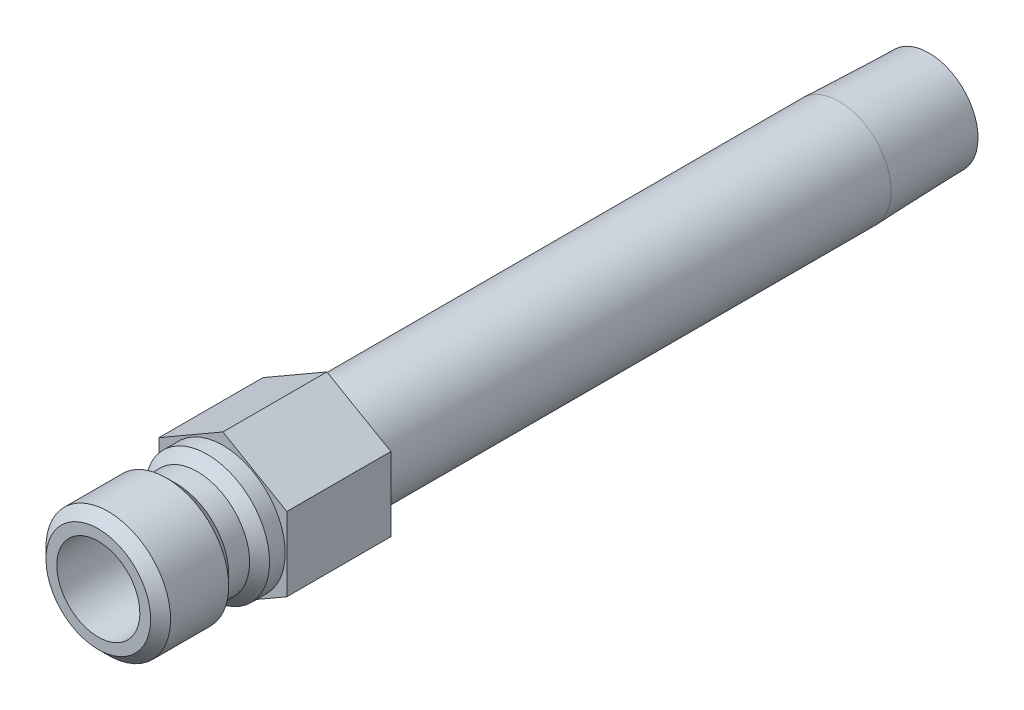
SolidWorks part; units mm, degrees
ref_plane "Front Plane" through (0, 0, 0) normal (0, 0, 1) x (1, 0, 0)
ref_plane "Top Plane" through (0, 0, 0) normal (0, 1, 0) x (1, 0, 0)
ref_plane "Right Plane" through (0, 0, 0) normal (1, 0, 0) x (0, 0, -1)
sketch "Sketch1" plane through (0, 0, 0) normal (1, 0, 0) x (0, 0, -1)
  line L0 (0, 0) -> (-12.7, 0) construction
  line L1 (-9.525, 3.175) -> (-9.525, 4.0005)
  line L2 (-3.556, 4.0005) -> (-3.556, 0) construction
  line L3 (-8.763, 4.7625) -> (-4.318, 4.7625)
  line L4 (0, 3.9688) -> (0, 3.175) construction
  line L5 (-3.556, 4.0005) -> (-1.9558, 4.0005)
  line L6 (-1.1938, 4.7625) -> (0, 4.7625)
  line L7 (0, 4.7625) -> (0, 3.9688)
  line L8 (-3.556, 4.0005) -> (-4.318, 4.7625)
  line L9 (-1.9558, 4.0005) -> (-1.1938, 4.7625)
  line L10 (-9.525, 4.0005) -> (-8.763, 4.7625)
  line L11 (0.127, 3.175) -> (0.127, 2.3813)
  line L12 (0, 3.9688) -> (47.117, 3.9688)
  line L13 (47.117, 3.9688) -> (53.975, 3.7544)
  line L14 (53.975, 3.7544) -> (53.975, 2.3813)
  line L15 (0, 0) -> (7.9502, 0) construction
  line L16 (7.9502, 0) -> (7.9502, 4.7625) construction
  line L17 (7.9502, 4.7625) -> (0, 4.7625) construction
  line L19 (0.127, 3.175) -> (-9.525, 3.175)
  line L20 (0.127, 2.3813) -> (53.975, 2.3813)
  line L21 (0, 2.6543) -> (0, 0) construction
  dimension "D1" = 9.525
  dimension "D2" = 1.6002
  dimension "D3" = 0.762
  dimension "D4" = 45
  dimension "D5" = 5.969
  dimension "D6" = 45
  dimension "D7" = 1.79
  dimension "D8" = 6.858
  dimension "D9" = 63.5
  dimension "D10" = 3.175
  dimension "D11" = 17.4752
  dimension "D12" = 6.35
  dimension "D13" = 4.7625
  dimension "D14" = 9.525
  dimension "D15" = 7.9375
  dimension "D16" = 9.652
revolve "Revolve1" add sketch "Sketch1" angle 360 about L0
sketch "Sketch2" plane through (0, 0, 0) normal (0, 0, 1) x (1, 0, 0)
  line L1 (-4.8895, 2.823) -> (-4.8895, -2.823)
  line L2 (-4.8895, -2.823) -> (0, -5.6459)
  line L3 (0, -5.6459) -> (4.8895, -2.823)
  line L4 (4.8895, -2.823) -> (4.8895, 2.823)
  line L5 (4.8895, 2.823) -> (0, 5.6459)
  line L6 (0, 5.6459) -> (-4.8895, 2.823)
  circle A0 centre (0, 0) radius 4.8895 construction
  circle A1 centre (0, 0) radius 2.3812 construction
  circle A2 centre (0, 0) radius 2.3812
  dimension "D1" = 9.779
extrude "Boss-Extrude1" add sketch "Sketch2" against normal up to vertex (7.9502 mm away) from vertex at 0
